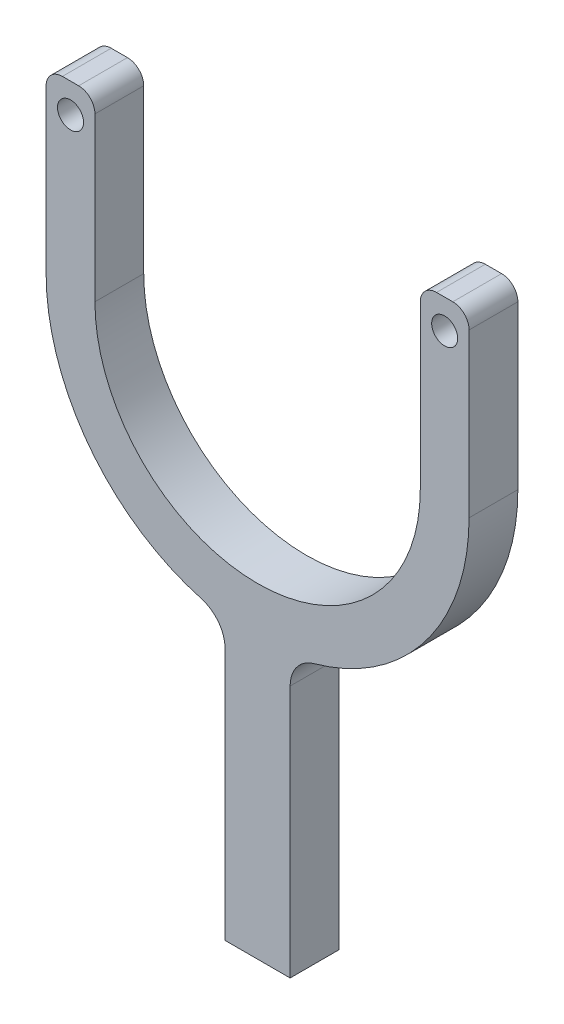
SolidWorks part; units mm, degrees
ref_plane "Front Plane" through (0, 0, 0) normal (0, 0, 1) x (1, 0, 0)
ref_plane "Top Plane" through (0, 0, 0) normal (0, 1, 0) x (1, 0, 0)
ref_plane "Right Plane" through (0, 0, 0) normal (1, 0, 0) x (0, 0, -1)
sketch "Sketch1" plane through (0, 0, 0) normal (0, 0, 1) x (1, 0, 0)
  line L1 (0, 0) -> (20, 0)
  line L2 (0, 0) -> (0, -100)
  line L3 (0, -100) -> (20, -100)
  line L4 (20, 0) -> (20, -100)
  dimension "D1" = 100
  dimension "D2" = 20
extrude "Extrude1" add sketch "Sketch1" along normal mid plane 15
sketch "Sketch2" plane through (0, 0, 0) normal (0, 0, 1) x (1, 0, 0)
  line L0 (10, 0) -> (10, 50) construction
  line L1 (20, 0) -> (0, 0) construction
  line L2 (-40, 50) -> (-40, 105)
  line L3 (60, 50) -> (60, 105)
  arc A0 (-40, 50) -> (60, 50) centre (10, 50) ccw
  dimension "D1" = 50
  dimension "D2" = 55
extrude "Extrude-Thin1" add sketch "Sketch2" along normal mid plane 15 thin
fillet "Fillet1" radius 10 2 edges at (20, -14.2262, 0) (0, -14.2262, 0)
sketch "Sketch3" plane through (0, 0, 7.5) normal (0, 0, 1) x (1, 0, 0)
  line L0 (-47.5, 105) -> (-47.5, 80.6019) construction
  line L1 (-55, 105) -> (-40, 105) construction
  line L2 (67.5, 105) -> (67.5, 80.6019) construction
  line L3 (60, 105) -> (75, 105) construction
  line L4 (-47.5, 96) -> (67.5, 96) construction
  circle A0 centre (-47.5, 96) radius 4
  circle A1 centre (67.5, 96) radius 4
  dimension "D1" = 8
  dimension "D2" = 9
extrude "Extrude2" cut sketch "Sketch3" against normal through all
fillet "Fillet2" radius 5 4 edges at (75, 105, 0) (60, 105, 0) (-40, 105, 0) (-55, 105, 0)
